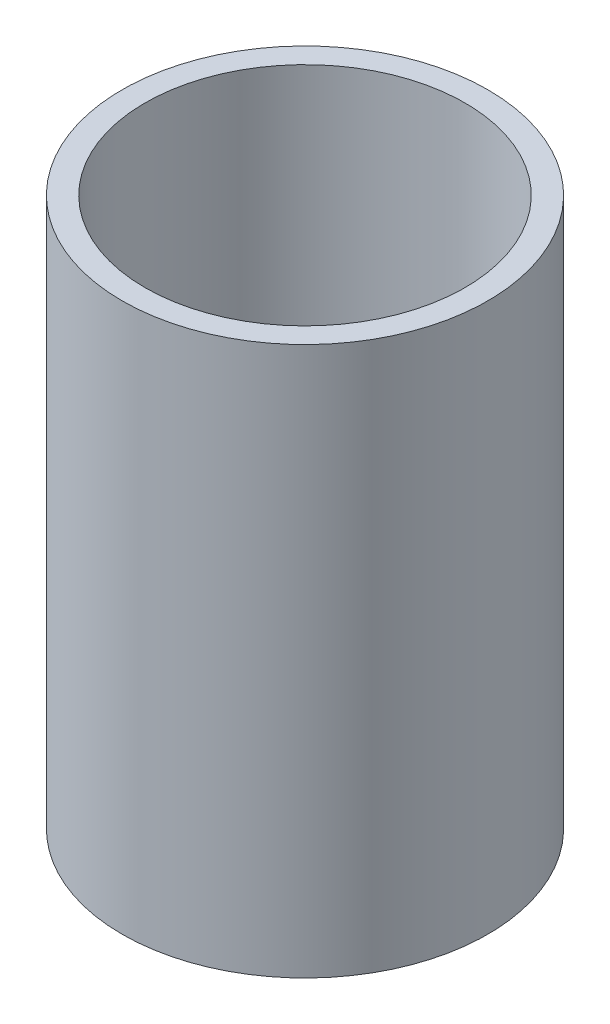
SolidWorks part; units mm, degrees
ref_plane "Front Plane" through (0, 0, 0) normal (0, 0, 1) x (1, 0, 0)
ref_plane "Top Plane" through (0, 0, 0) normal (0, 1, 0) x (1, 0, 0)
ref_plane "Right Plane" through (0, 0, 0) normal (1, 0, 0) x (0, 0, -1)
sketch "Sketch1" plane through (0, 0, 0) normal (0, 1, 0) x (1, 0, 0)
  circle A0 centre (0, 0) radius 12.7
extrude "Extrude1" add sketch "Sketch1" along normal blind 38.1
sketch "Sketch2" plane through (0, 38.1, 0) normal (0, 1, 0) x (1, 0, 0)
  circle A0 centre (0, 0) radius 11.1125
extrude "Extrude2" cut sketch "Sketch2" against normal through all
